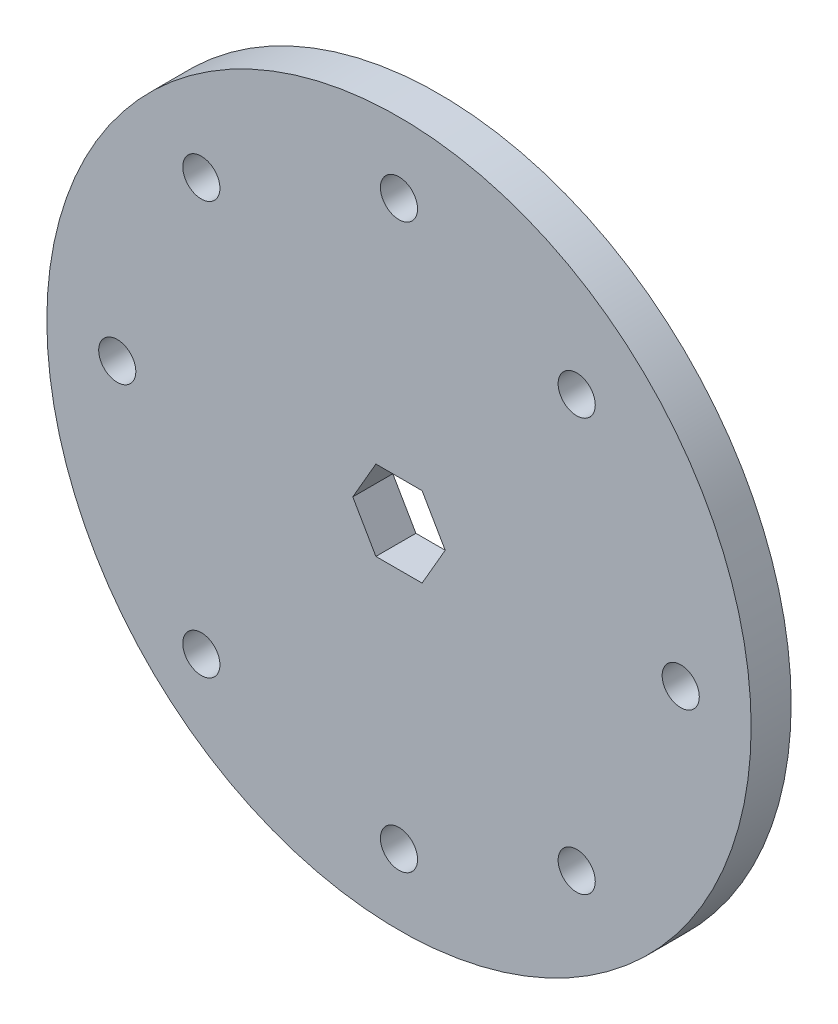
SolidWorks part; units mm, degrees
ref_plane "Front Plane" through (0, 0, 0) normal (0, 0, 1) x (1, 0, 0)
ref_plane "Top Plane" through (0, 0, 0) normal (0, 1, 0) x (1, 0, 0)
ref_plane "Right Plane" through (0, 0, 0) normal (1, 0, 0) x (0, 0, -1)
sketch "Sketch2" plane through (0, 0, 0) normal (0, 0, 1) x (1, 0, 0)
  circle A0 centre (0, 0) radius 27.94
  dimension "D1" = 55.88
extrude "Boss-Extrude1" add sketch "Sketch2" along normal blind 3.175
sketch "Sketch5" plane through (0, 0, 3.175) normal (0, 0, 1) x (1, 0, 0)
  line L0 (0, 0) -> (43301.2702, -25000) construction
  line L1 (3.6662, 0) -> (1.8331, 3.175)
  line L3 (1.8331, 3.175) -> (-1.8331, 3.175)
  line L4 (-1.8331, 3.175) -> (-3.6662, 0)
  line L5 (-3.6662, 0) -> (-1.8331, -3.175)
  line L6 (-1.8331, -3.175) -> (1.8331, -3.175)
  line L7 (1.8331, -3.175) -> (3.6662, 0)
  circle A4 centre (0, 0) radius 3.175 construction
  point P15 (0, 0)
  point P25 (2.7496, -1.5875)
  dimension "D4" = 6.35
extrude "Cut-Extrude2" cut sketch "Sketch5" against normal through all
hole_wizard "#4 Clearance Hole1" positions "Sketch7" profile "Sketch6" hole size "#4" standard "ANSI Inch"
sketch "Sketch7" plane through (0, 0, 3.175) normal (0, 0, 1) x (1, 0, 0)
  point P0 (-22.352, 0)
  point P2 (22.352, 0)
  point P6 (0, 22.352)
  point P8 (0, -22.352)
  point P11 (14.0989, 15.9291)
  point P13 (-15.6804, 15.9291)
  point P15 (-15.6804, -16.8091)
  point P17 (14.0989, -16.8091)
  dimension "D1" = 22.352
  dimension "D2" = 22.352
  dimension "D3" = 22.352
  dimension "D4" = 22.352
  dimension "D5" = 22.352
sketch "Sketch6" plane through (-22.352, 0, 3.175) normal (1, 0, 0) x (0, -1, 0)
  line L0 (0, 0) -> (0, 3.175)
  line L1 (0, 3.175) -> (1.4732, 3.175)
  line L2 (1.4732, 3.175) -> (1.4732, 0)
  line L5 (1.4732, 0) -> (0, 0)
  line L11 (0, -6.35) -> (0, 107.95) construction
  dimension "Thru Hole Dia." = 2.9464
  dimension "Thru Hole Depth" = 3.175
